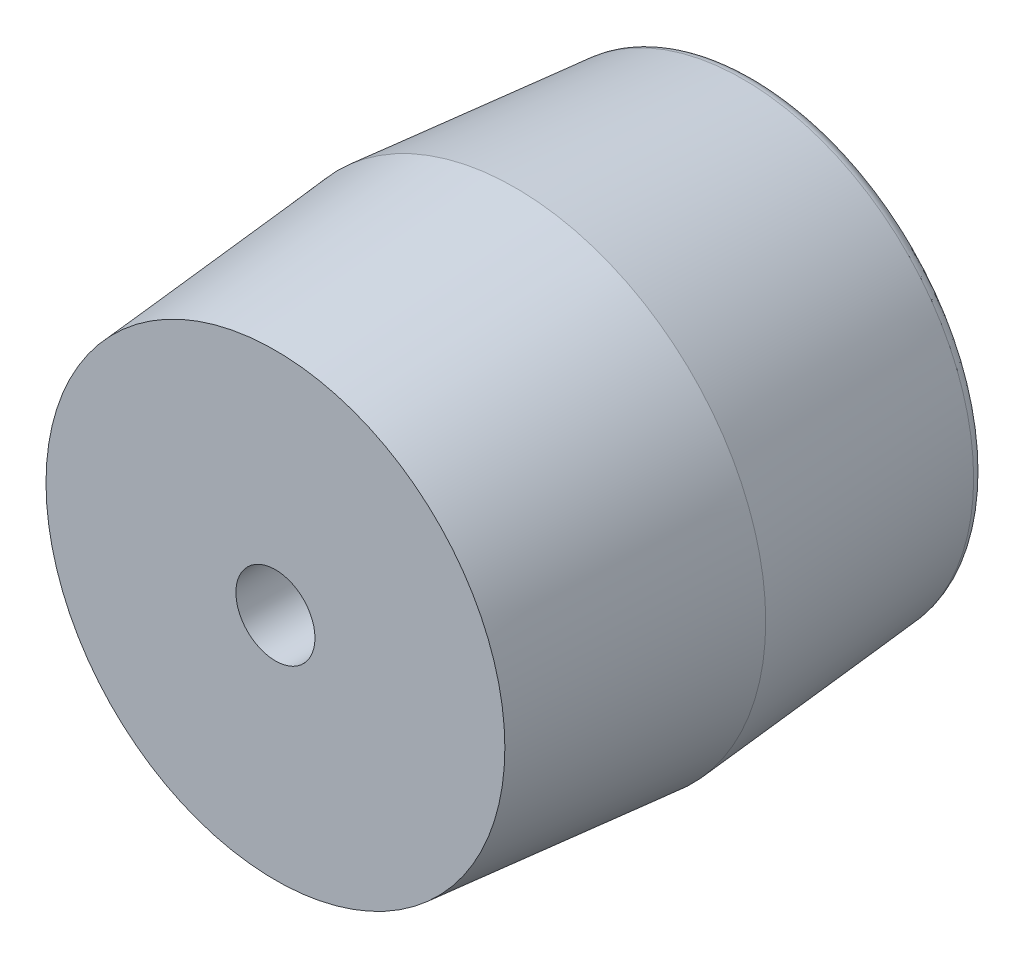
SolidWorks part; units mm, degrees
other "<Om 2>-<Cut-Extrude1>"
ref_plane "Front Plane" through (0, 0, 0) normal (0, 0, 1) x (1, 0, 0)
ref_plane "Top Plane" through (0, 0, 0) normal (0, 1, 0) x (1, 0, 0)
ref_plane "Right Plane" through (0, 0, 0) normal (1, 0, 0) x (0, 0, -1)
mirrored part "Om 2_Mirrored"
